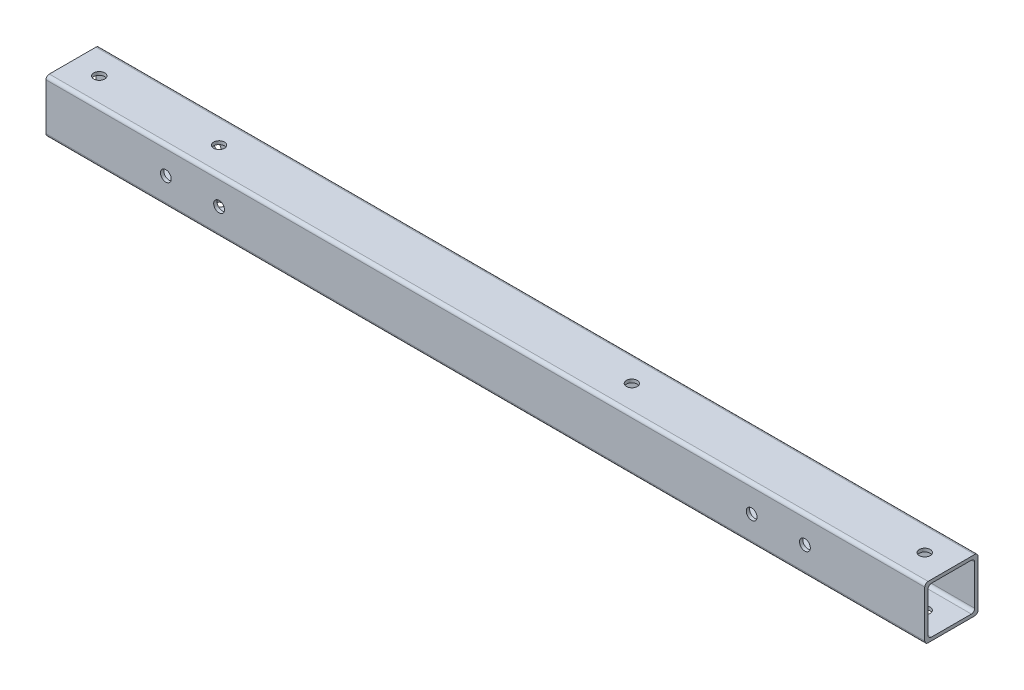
SolidWorks part; units mm, degrees
ref_plane "Front Plane" through (0, 0, 0) normal (0, 0, 1) x (1, 0, 0)
ref_plane "Top Plane" through (0, 0, 0) normal (0, 1, 0) x (1, 0, 0)
ref_plane "Right Plane" through (0, 0, 0) normal (1, 0, 0) x (0, 0, -1)
sketch "Sketch1" plane through (0, 0, 0) normal (0, 1, 0) x (1, 0, 0)
  line L1 (0, 0) -> (-1676.4, 0)
  line L2 (0, 0) -> (0, -101.6)
  line L3 (0, -101.6) -> (-1676.4, -101.6)
  line L4 (-1676.4, 0) -> (-1676.4, -101.6)
  dimension "D1" = 1676.4
  dimension "D2" = 101.6
extrude "Extrude1" add sketch "Sketch1" along normal blind 101.6
sketch "Sketch2" plane through (-1676.4, 0, 0) normal (-1, 0, 0) x (0, 0, 1)
  line L0 (0, 101.6) -> (101.6, 101.6) construction
  line L1 (6.35, 95.25) -> (95.25, 95.25)
  line L2 (6.35, 95.25) -> (6.35, 6.35)
  line L3 (6.35, 6.35) -> (95.25, 6.35)
  line L4 (95.25, 95.25) -> (95.25, 6.35)
  line L5 (0, 0) -> (101.6, 0) construction
  line L6 (101.6, 101.6) -> (101.6, 0) construction
  line L7 (0, 101.6) -> (0, 0) construction
  dimension "D1" = 6.35
  dimension "D2" = 6.35
  dimension "D3" = 6.35
  dimension "D4" = 6.35
extrude "Cut-Extrude1" cut sketch "Sketch2" against normal up to next
sketch "Sketch3" plane through (0, 101.6, 0) normal (0, 1, 0) x (1, 0, 0)
  line L0 (-1676.4, 0) -> (-1676.4, -101.6) construction
  line L1 (-1676.4, -101.6) -> (0, -101.6) construction
  circle A0 centre (-1625.6, -50.8) radius 10.3188
  dimension "D1" = 20.6375
  dimension "D2" = 50.8
  dimension "D3" = 50.8
extrude "Cut-Extrude2" cut sketch "Sketch3" against normal through all
fillet "Fillet1" radius 6.35 8 edges at (-838.2, 6.35, 95.25) (-838.2, 0, 101.6) (-838.2, 101.6, 101.6) (-838.2, 95.25, 95.25) (-838.2, 95.25, 6.35) (-838.2, 101.6, 0) (-838.2, 6.35, 6.35) (-838.2, 0, 0)
sketch "Sketch5" plane through (0, 0, 0) normal (0, 0, -1) x (-1, 0, 0)
  line L0 (1676.4, 95.25) -> (1676.4, 6.35) construction
  line L1 (0, 6.35) -> (1676.4, 6.35) construction
  circle A0 centre (1447.8, 50.8) radius 10.3188
  circle A1 centre (1346.2, 50.8) radius 10.3188
  dimension "D1" = 20.6375
  dimension "D2" = 228.6
  dimension "D3" = 330.2
  dimension "D4" = 44.45
extrude "Cut-Extrude4" cut sketch "Sketch5" against normal blind 101.6
ref_plane "Plane1" through (-838.2, 0, 0) normal (1, 0, 0) x (0, 0, -1)
mirror "Mirror1" about plane through (-838.2, 0, 0) normal (1, 0, 0) of "Cut-Extrude4", "Cut-Extrude2"
sketch "Sketch6" plane through (0, 101.6, 0) normal (0, 1, 0) x (1, 0, 0)
  line L0 (0, -95.25) -> (0, -6.35) construction
  line L1 (0, -6.35) -> (-1676.4, -6.35) construction
  circle A0 centre (-609.6, -50.8) radius 10.3188
  dimension "D1" = 20.6375
  dimension "D2" = 609.6
  dimension "D3" = 44.45
extrude "Cut-Extrude5" cut sketch "Sketch6" against normal blind 101.6
sketch "Sketch8" plane through (0, 101.6, 0) normal (0, 1, 0) x (1, 0, 0)
  line L0 (0, -95.25) -> (0, -6.35) construction
  line L1 (0, -6.35) -> (-1676.4, -6.35) construction
  circle A0 centre (-1397, -50.8) radius 10.3188
  dimension "D1" = 20.6375
  dimension "D2" = 1397
  dimension "D3" = 44.45
extrude "Cut-Extrude7" cut sketch "Sketch8" against normal blind 101.6
